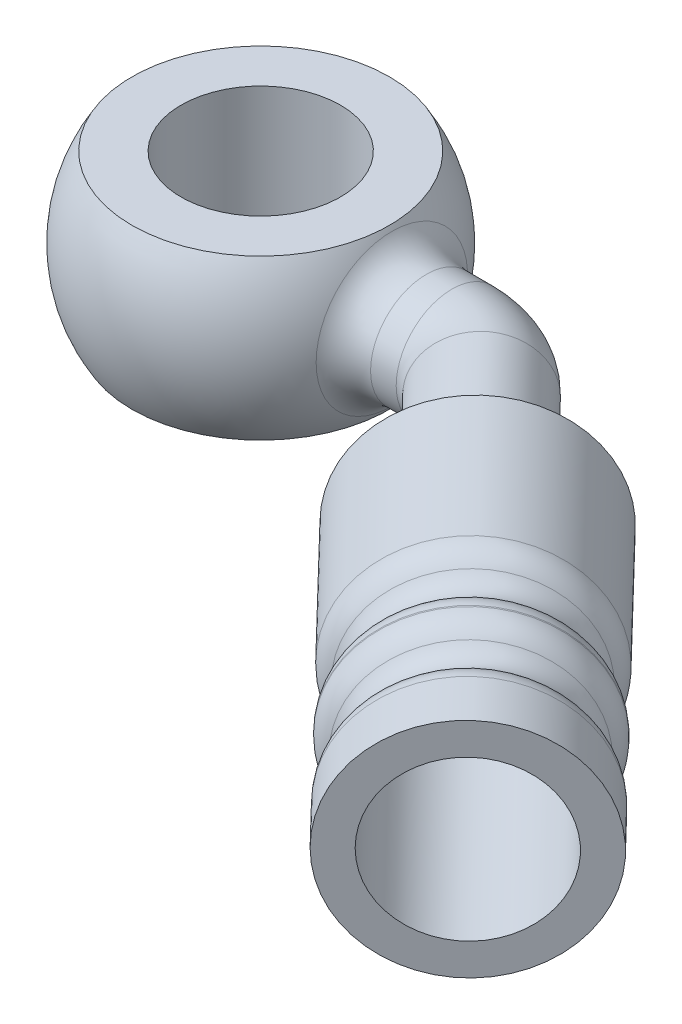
SolidWorks part; units mm, degrees
ref_plane "Plan1" through (0, 0, 0) normal (0, 0, 1) x (1, 0, 0)
ref_plane "Plan2" through (0, 0, 0) normal (0, 1, 0) x (1, 0, 0)
ref_plane "Plan3" through (0, 0, 0) normal (1, 0, 0) x (0, 0, -1)
sketch "Esquisse1" plane through (0, 0, 0) normal (0, 0, 1) x (1, 0, 0)
  line L0 (0, -50) -> (0, 60) construction
  line L1 (5, 5) -> (8.0777, 5)
  line L2 (5, 5) -> (5, -5)
  line L3 (5, -5) -> (8.0777, -5)
  arc A0 (8.0777, -5) -> (8.0777, 5) centre (0, 0) ccw
  point P8 (5, 0)
  dimension "D2" = 9.5
  dimension "D1" = 10
  dimension "D3" = 5
revolve "Base-Révolution" add sketch "Esquisse1" angle 360 about L0
sketch "Esquisse2" plane through (0, 0, 0) normal (0, 0, 1) x (1, 0, 0)
  line L1 (-8.3666, 4.5) -> (-9.5, 4.5)
  line L2 (-8.3666, 4.5) -> (-8.3666, -4.5)
  line L3 (-8.3666, -4.5) -> (-9.5, -4.5)
  line L4 (-9.5, 4.5) -> (-9.5, -4.5)
  arc A0 (-8.0777, 5) -> (-8.0777, -5) centre (0, 0) ccw construction
  point P7 (-8.3666, 0)
  dimension "D1" = 9
extrude "Enlèv. mat.-Extru.1" cut sketch "Esquisse2" against normal through all and the other way through all
ref_plane "Plan4" through (45, 0, 0) normal (1, 0, 0) x (0, 0, -1)
sketch "Esquisse4" plane through (45, 0, 0) normal (1, 0, 0) x (0, 0, -1)
  line L0 (0, 30) -> (0, -30) construction
  line L1 (0, -50) -> (0, 60) construction
ref_plane "Plan5" through (21.7148, 0, 22.4863) normal (0.6947, 0, 0.7193) x (0.7193, 0, -0.6947)
sketch "Esquisse5" plane through (21.7148, 0, 22.4863) normal (0.6947, 0, 0.7193) x (0.7193, 0, -0.6947)
  circle A0 centre (10, 0) radius 3.5
  dimension "D1" = 7
  dimension "D2" = 10
sketch "Esquisse6" plane through (0, 0, 0) normal (0, 1, 0) x (1, 0, 0)
  line L0 (0, 0) -> (12, 0)
  line L1 (28.9082, -15.5397) -> (15.2226, -1.3679)
  line L2 (-14.2522, -57.2192) -> (57.6818, 12.2466) construction
  line L4 (26.3905, -17.971) -> (31.4258, -13.1084)
  line L5 (26.3905, -17.971) -> (31.4258, -13.1084) construction
  arc A0 (12, 0) -> (15.2226, -1.3679) centre (12, -4.48) cw
  dimension "D2" = 12
  dimension "D1" = 0
sweep "Boss.-Balayage1" add profiles "Esquisse5" path "Esquisse6"
sketch "Esquisse8" plane through (0, 0, 0) normal (0, 1, 0) x (1, 0, 0)
  line L0 (28.9082, -15.5397) -> (15.2226, -1.3679)
  line L1 (-14.2522, -57.2192) -> (57.6818, 12.2466) construction
  line L2 (15.2226, -1.3679) -> (28.9082, -15.5397) construction
  line L3 (0, 0) -> (12, 0)
  line L4 (12, 0) -> (8.8318, 0) construction
  line L6 (26.3905, -17.971) -> (31.4258, -13.1084)
  line L7 (26.3905, -17.971) -> (31.4258, -13.1084) construction
  arc A0 (12, 0) -> (15.2226, -1.3679) centre (12, -4.48) cw
  dimension "D2" = 12
  dimension "D1" = 0
sketch "Esquisse7" plane through (21.7148, 0, 22.4863) normal (0.6947, 0, 0.7193) x (0.7193, 0, -0.6947)
  circle A0 centre (10, 0) radius 1
  dimension "D1" = 2
sweep "Enlèvement de matière-Balayage1" cut profiles "Esquisse7" path "Esquisse8"
sketch "Esquisse9" plane through (0, 5, 0) normal (0, 1, 0) x (-1, 0, 0)
  circle A0 centre (0, 0) radius 5 construction
  circle A1 centre (0, 0) radius 5
extrude "Enlèv. mat.-Extru.2" cut sketch "Esquisse9" against normal through all
fillet "Congé1" radius 2.5
sketch "Esquisse10" plane through (0, 0, 0) normal (0, 1, 0) x (1, 0, 0)
  line L0 (31.4258, -13.1084) -> (17.7403, 1.0634) construction
  line L1 (31.4258, -13.1084) -> (17.7403, 1.0634) construction
  line L2 (24.5831, -6.0225) -> (27.1008, -3.5912)
  line L3 (27.1008, -3.5912) -> (35.4367, -12.2233)
  line L4 (-14.2522, -57.2192) -> (57.6818, 12.2466) construction
  line L5 (37.4915, -14.3511) -> (39.2281, -16.1495)
  line L7 (41.283, -18.2773) -> (44.4672, -21.5747)
  line L8 (26.3905, -17.971) -> (31.4258, -13.1084) construction
  line L9 (26.3905, -17.971) -> (31.4258, -13.1084) construction
  line L10 (28.9082, -15.5397) -> (45.361, -32.5771) construction
  line L11 (15.2226, -1.3679) -> (28.9082, -15.5397) construction
  line L12 (24.5831, -6.0225) -> (31.4258, -13.1084)
  line L13 (44.4672, -21.5747) -> (43.0285, -22.964)
  line L14 (36.6439, -13.1135) -> (40.4354, -17.0397) construction
  line L15 (43.0285, -22.964) -> (32.5049, -12.0664)
  line L16 (32.5049, -12.0664) -> (31.4258, -13.1084)
  arc A0 (39.2281, -16.1495) -> (41.283, -18.2773) centre (40.4354, -17.0397) ccw
  arc A1 (35.4367, -12.2233) -> (37.4915, -14.3511) centre (36.6439, -13.1135) ccw
  dimension "D2" = 1.5
  dimension "D3" = 1.5
  dimension "D1" = 7
  dimension "D4" = 0.25
  dimension "D5" = 25
  dimension "D6" = 5
  dimension "D7" = 2.5
  dimension "D8" = 12
revolve "Boss.-Révol.1" add sketch "Esquisse10" angle 360 about L10
fillet "Congé2" radius 2.5
fillet "Congé3" radius 2
